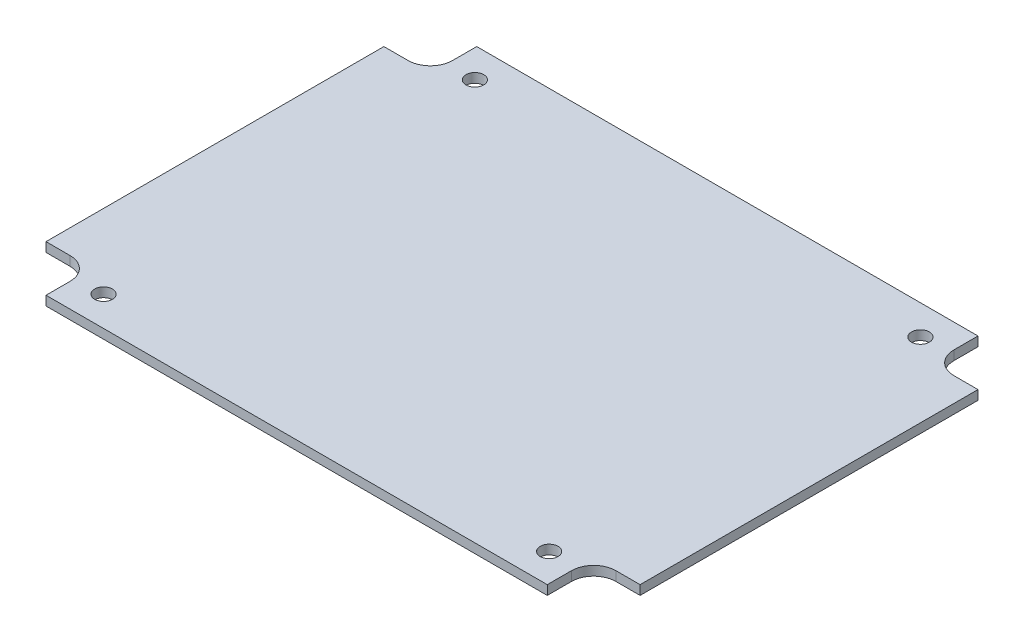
SolidWorks part; units mm, degrees
ref_plane "Front Plane" through (0, 0, 0) normal (0, 0, 1) x (1, 0, 0)
ref_plane "Top Plane" through (0, 0, 0) normal (0, 1, 0) x (1, 0, 0)
ref_plane "Right Plane" through (0, 0, 0) normal (1, 0, 0) x (0, 0, -1)
sketch "Sketch1" plane through (0, 0, 0) normal (0, 1, 0) x (1, 0, 0)
  line L0 (50.8, 73.66) -> (50.8, 0) construction
  line L1 (0, 0) -> (101.6, 0)
  line L2 (0, 0) -> (0, 73.66)
  line L3 (0, 73.66) -> (101.6, 73.66)
  line L4 (101.6, 0) -> (101.6, 73.66)
  line L5 (0, 36.83) -> (101.6, 36.83) construction
  dimension "D1" = 101.6
  dimension "D2" = 73.66
extrude "Extrude1" add sketch "Sketch1" along normal blind 1.6002
sketch "Sketch2" plane through (0, 1.6002, 0) normal (0, 1, 0) x (-1, 0, 0)
  line L0 (-50.8, 0) -> (-50.8, -73.66) construction
  line L1 (0, 0) -> (-101.6, 0) construction
  line L2 (-101.6, -73.66) -> (0, -73.66) construction
  line L3 (-101.6, -36.83) -> (0, -36.83) construction
  line L4 (-101.6, 0) -> (-101.6, -73.66) construction
  line L5 (0, -73.66) -> (0, 0) construction
  line L6 (-93.6625, -73.66) -> (-93.6625, -69.5325)
  line L7 (-101.6, 0) -> (-93.6625, 0)
  line L8 (-101.6, 0) -> (-101.6, -7.9375)
  line L9 (-101.6, -7.9375) -> (-97.4725, -7.9375)
  line L10 (-93.6625, 0) -> (-93.6625, -4.1275)
  line L11 (-101.6, -65.7225) -> (-97.4725, -65.7225)
  line L12 (-101.6, -73.66) -> (-101.6, -65.7225)
  line L13 (-101.6, -73.66) -> (-93.6625, -73.66)
  line L14 (0, -73.66) -> (-7.9375, -73.66)
  line L15 (0, -73.66) -> (0, -65.7225)
  line L16 (0, -65.7225) -> (-4.1275, -65.7225)
  line L17 (-7.9375, 0) -> (-7.9375, -4.1275)
  line L18 (0, -7.9375) -> (-4.1275, -7.9375)
  line L19 (0, 0) -> (0, -7.9375)
  line L20 (0, 0) -> (-7.9375, 0)
  line L21 (-7.9375, -73.66) -> (-7.9375, -69.5325)
  arc A0 (-97.4725, -7.9375) -> (-93.6625, -4.1275) centre (-97.4725, -4.1275) ccw
  arc A1 (-97.4725, -65.7225) -> (-93.6625, -69.5325) centre (-97.4725, -69.5325) cw
  arc A2 (-4.1275, -65.7225) -> (-7.9375, -69.5325) centre (-4.1275, -69.5325) ccw
  arc A3 (-4.1275, -7.9375) -> (-7.9375, -4.1275) centre (-4.1275, -4.1275) cw
  dimension "D5" = 3.81
  dimension "D1" = 7.9375
  dimension "D2" = 7.9375
  dimension "D3" = 3.81
  dimension "D4" = 3.81
extrude "Cut-Extrude1" cut sketch "Sketch2" against normal through all
sketch "Sketch3" plane through (0, 1.6002, 0) normal (0, 1, 0) x (-1, 0, 0)
  line L0 (-50.8, 0) -> (-50.8, -73.66) construction
  line L1 (-7.9375, 0) -> (-93.6625, 0) construction
  line L2 (-93.6625, -73.66) -> (-7.9375, -73.66) construction
  line L3 (-101.6, -36.83) -> (0, -36.83) construction
  line L4 (-101.6, -7.9375) -> (-101.6, -65.7225) construction
  line L5 (0, -65.7225) -> (0, -7.9375) construction
  circle A0 centre (-88.9, -5.08) radius 1.524
  circle A1 centre (-88.9, -68.58) radius 1.524
  circle A2 centre (-12.7, -68.58) radius 1.524
  circle A3 centre (-12.7, -5.08) radius 1.524
  dimension "D1" = 3.048
  dimension "D2" = 12.7
  dimension "D3" = 5.08
extrude "Cut-Extrude2" cut sketch "Sketch3" against normal through all
